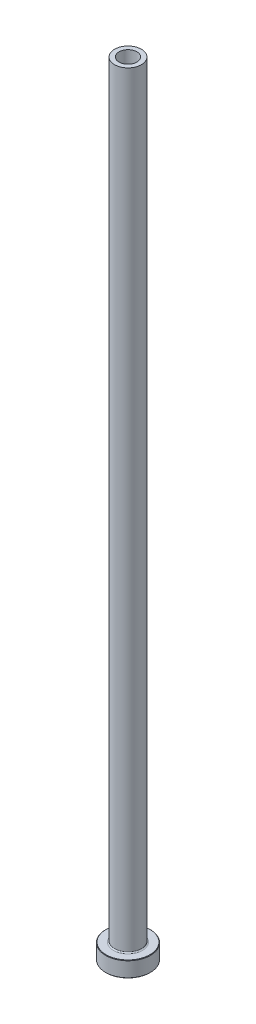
SolidWorks part; units mm, degrees
ref_plane "Front Plane" through (0, 0, 0) normal (0, 0, 1) x (1, 0, 0)
ref_plane "Top Plane" through (0, 0, 0) normal (0, 1, 0) x (1, 0, 0)
ref_plane "Right Plane" through (0, 0, 0) normal (1, 0, 0) x (0, 0, -1)
sketch "Sketch1" plane through (0, 0, 0) normal (0, 0, 1) x (1, 0, 0)
  line L0 (-4, 350) -> (-6, 350)
  line L1 (-6, 350) -> (-6, 7)
  line L2 (-6, 7) -> (-10, 7)
  line L3 (-10, 7) -> (-10, 0)
  line L4 (11, 0) -> (-11, 0) construction
  line L5 (-10, 0) -> (-4.25, 0)
  line L6 (-4, 305) -> (-4, 350)
  line L7 (0, 92.1877) -> (0, -15.5353) construction
  line L8 (0, -11) -> (0, 11) construction
  line L9 (-4, 305) -> (-4.25, 293)
  line L10 (-4.25, 293) -> (-4.25, 0)
  dimension "D1" = 0.25
  dimension "ID" = 8
  dimension "OD" = 12
  dimension "L" = 350
  dimension "H" = 20
  dimension "T" = 7
  dimension "N" = 45
  dimension "D2" = 12
revolve "Revolve1" add sketch "Sketch1" angle 360 about L7
fillet "Fillet1" radius 0.5 1 edges at (0, 7, 6)
chamfer "Chamfer1" distance 0.2 angle 45 2 edges at (0, 7, 10) (0, 0, 10)
chamfer "Chamfer3" distance 0.5 angle 45 1 edges at (0, 0, 4.25)
